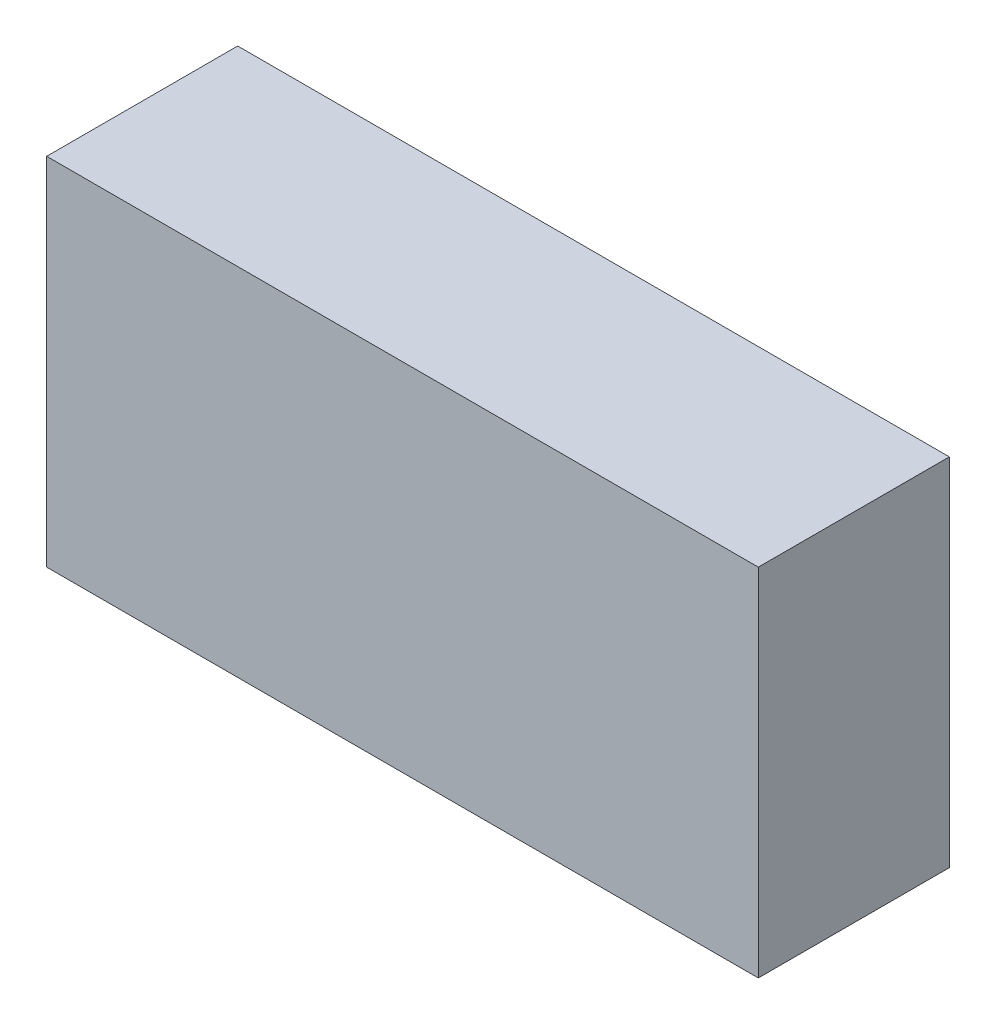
SolidWorks part; units mm, degrees
ref_plane "Front Plane" through (0, 0, 0) normal (0, 0, 1) x (1, 0, 0)
ref_plane "Top Plane" through (0, 0, 0) normal (0, 1, 0) x (1, 0, 0)
ref_plane "Right Plane" through (0, 0, 0) normal (1, 0, 0) x (0, 0, -1)
sketch "Component_Outline" plane through (0, 0, 0) normal (0, 0, 1) x (1, 0, 0)
  line L0 (-0.5588, 0.2794) -> (0.5588, 0.2794)
  line L1 (0.5588, 0.2794) -> (0.5588, -0.2794)
  line L2 (0.5588, -0.2794) -> (-0.5588, -0.2794)
  line L3 (-0.5588, -0.2794) -> (-0.5588, 0.2794)
extrude "Boss-Extrude1" add sketch "Component_Outline" along normal blind 0.3
